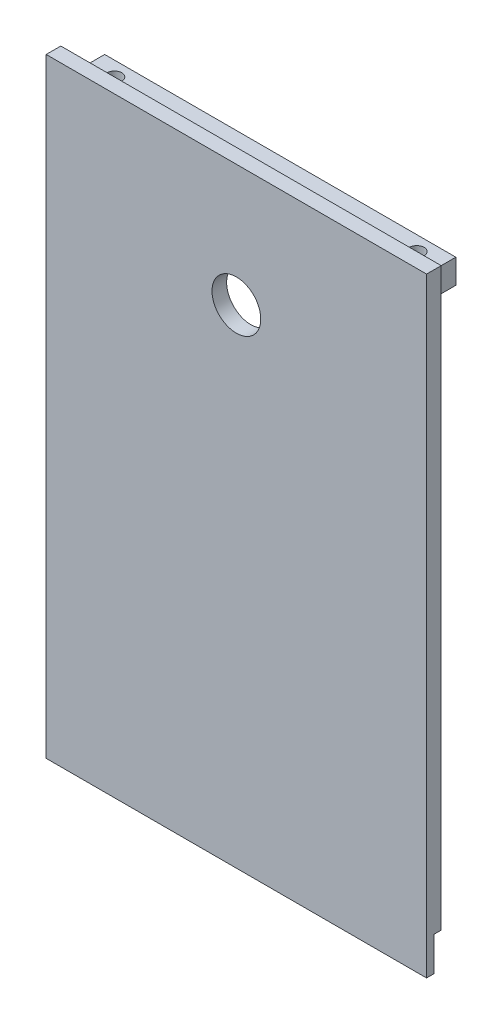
SolidWorks part; units mm, degrees
ref_plane "Front Plane" through (0, 0, 0) normal (0, 0, 1) x (1, 0, 0)
ref_plane "Top Plane" through (0, 0, 0) normal (0, 1, 0) x (1, 0, 0)
ref_plane "Right Plane" through (0, 0, 0) normal (1, 0, 0) x (0, 0, -1)
sketch "Sketch1" plane through (0, 0, 0) normal (0, 0, 1) x (1, 0, 0)
  line L1 (-39, 124.5) -> (39, 124.5)
  line L2 (-39, 124.5) -> (-39, -124.5)
  line L3 (-39, -124.5) -> (39, -124.5)
  line L4 (39, 124.5) -> (39, -124.5)
  line L5 (-39, 124.5) -> (39, -124.5) construction
  line L6 (-39, -124.5) -> (39, 124.5) construction
  point P0 (0, 0)
  dimension "D1" = 249
  dimension "D2" = 78
extrude "Boss-Extrude1" add sketch "Sketch1" along normal blind 3
sketch "Sketch3" plane through (-39, 0, 0) normal (-1, 0, 0) x (0, 0, 1)
  line L0 (3, -124.5) -> (0, -124.5)
  line L1 (0, -124.5) -> (0, -121.5)
  line L2 (0, 124.5) -> (3, 124.5)
  line L3 (3, 124.5) -> (3, -124.5)
  line L4 (0, -121.5) -> (-6, -121.5)
  line L5 (-6, -121.5) -> (-6, -116.5)
  line L6 (-6, -116.5) -> (0, -116.5)
  line L7 (0, 121.5) -> (-6, 121.5)
  line L8 (-6, 121.5) -> (-6, 116.5)
  line L9 (-6, 116.5) -> (0, 116.5)
  line L10 (0, -116.5) -> (0, 116.5)
  line L11 (0, 121.5) -> (0, 124.5)
  dimension "D1" = 3
  dimension "D2" = 3
  dimension "D3" = 6
  dimension "D4" = 5
extrude "Boss-Extrude2" add sketch "Sketch3" against normal through all
sketch "Sketch5" plane through (0, -121.5, 0) normal (0, -1, 0) x (-1, 0, 0)
  line L0 (56.4821, 0) -> (-56.4821, 0) construction
  line L1 (39, 6) -> (39, 0)
  line L2 (39, 0) -> (36, 0)
  line L3 (36, 0) -> (36, 6)
  line L4 (-39, 6) -> (39, 6) construction
  line L5 (36, 6) -> (39, 6)
  line L6 (-39, 0) -> (-39, 6)
  line L7 (-39, 6) -> (-36, 6)
  line L8 (-36, 6) -> (-36, 0)
  line L9 (-36, 0) -> (-39, 0)
  point P4 (0, 0)
  dimension "D1" = 3
  dimension "D2" = 3
extrude "Cut-Extrude1" cut sketch "Sketch5" against normal through all
sketch "Sketch6" plane through (0, -121.5, 0) normal (0, -1, 0) x (1, 0, 0)
  line L2 (36, 0) -> (-36, 0) construction
  line L3 (-36, -6) -> (-36, 0) construction
  line L4 (36, 0) -> (36, -6) construction
  circle A0 centre (-31, -3) radius 1.5
  circle A1 centre (31, -3) radius 1.5
  dimension "D1" = 3
  dimension "D2" = 3
  dimension "D4" = 5
  dimension "D3" = 5
  dimension "D5" = 3
extrude "Cut-Extrude2" cut sketch "Sketch6" against normal through all
sketch "Sketch7" plane through (0, 0, 3) normal (0, 0, 1) x (1, 0, 0)
  line L0 (0, -162.0343) -> (0, 162.0343) construction
  line L1 (39, 124.5) -> (-39, 124.5) construction
  circle A0 centre (0, 99.5) radius 5
  point P4 (0, 0)
  dimension "D1" = 10
  dimension "D2" = 25
extrude "Cut-Extrude3" cut sketch "Sketch7" against normal through all
sketch "Sketch8" plane through (-39, 0, 0) normal (-1, 0, 0) x (0, 0, 1)
  line L0 (3, -124.5) -> (0, -124.5)
  line L1 (0, -124.5) -> (0, -121.5)
  line L2 (0, -121.5) -> (-6, -121.5)
  line L3 (-6, -121.5) -> (-6, -116.5)
  line L4 (-6, -116.5) -> (0, -116.5)
  line L5 (0, -116.5) -> (0, 6.5)
  line L6 (0, 124.5) -> (0, -124.5) construction
  line L7 (0, 6.5) -> (1.5, 6.5)
  line L8 (1.5, 6.5) -> (1.5, -0.5)
  line L9 (1.5, -0.5) -> (3, -0.5)
  line L10 (3, 124.5) -> (3, -124.5) construction
  line L11 (3, -0.5) -> (3, -124.5)
  line L13 (-6, -116.5) -> (-6, -121.5) construction
  line L14 (0, -116.5) -> (-6, -116.5) construction
  line L15 (-6, -121.5) -> (0, -121.5) construction
  dimension "D1" = 131
  dimension "D2" = 7
  dimension "D3" = 1.5
extrude "Cut-Extrude4" cut sketch "Sketch8" against normal through all
